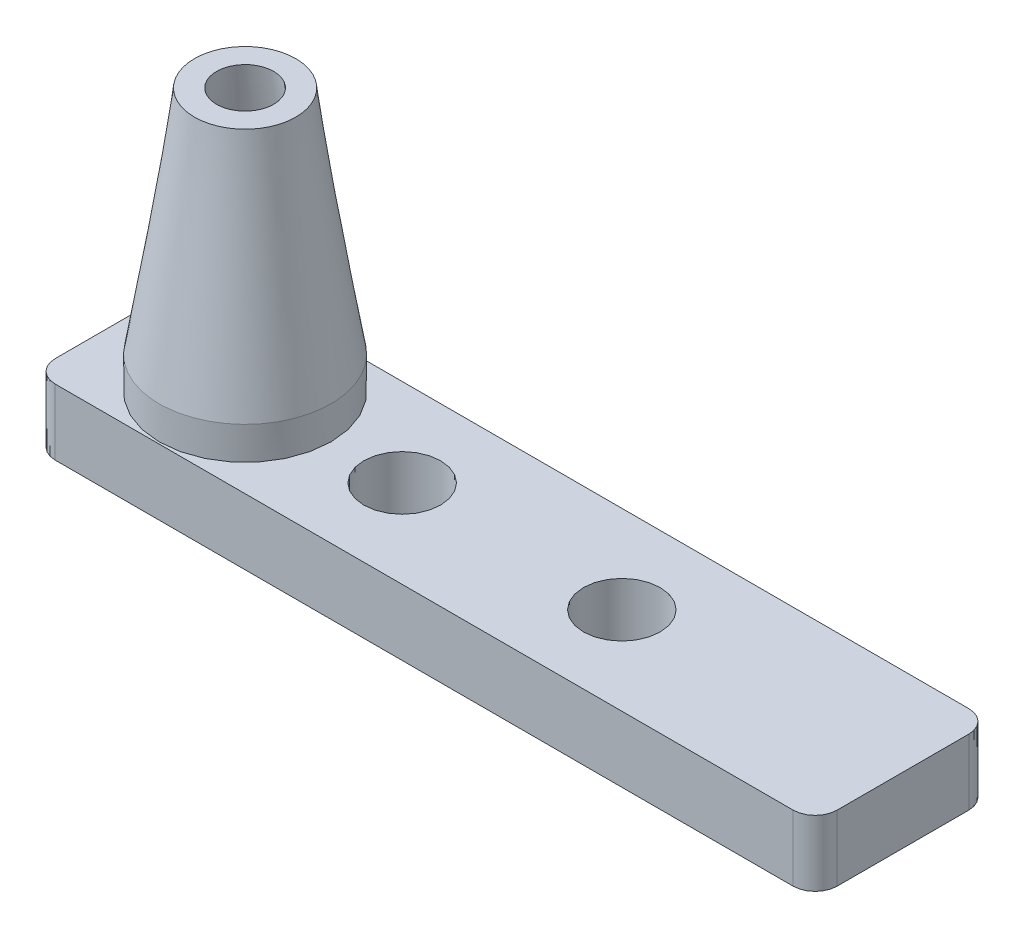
SolidWorks part; units mm, degrees
ref_plane "前视基准面" through (0, 0, 0) normal (0, 0, 1) x (1, 0, 0)
ref_plane "上视基准面" through (0, 0, 0) normal (0, 1, 0) x (1, 0, 0)
ref_plane "右视基准面" through (0, 0, 0) normal (1, 0, 0) x (0, 0, -1)
sketch "草图1" plane through (0, 0, 0) normal (0, 1, 0) x (1, 0, 0)
  line L0 (-34.4545, 0) -> (25.7273, 0) construction
  line L1 (-17.8, 4) -> (17.8, 4)
  line L2 (-17.8, 4) -> (-17.8, -4)
  line L3 (-17.8, -4) -> (17.8, -4)
  line L4 (17.8, 4) -> (17.8, -4)
  line L5 (-17.8, 4) -> (17.8, -4) construction
  line L6 (-17.8, -4) -> (17.8, 4) construction
  line L7 (0, 25.0909) -> (0, -26) construction
  point P0 (0, 0)
  dimension "D1" = 8
  dimension "D2" = 35.6
extrude "凸台-拉伸1" add sketch "草图1" against normal blind 4.5
sketch "草图2" plane through (0, 0, 0) normal (0, 1, 0) x (1, 0, 0)
  line L0 (0, 11.2893) -> (0, -8.6952) construction
  line L1 (-18.3992, 0) -> (19.424, 0) construction
  circle A0 centre (-12.15, 0) radius 2.9
  dimension "D2" = 5.8
  dimension "D1" = 12.15
ref_plane "基准面4" through (0, 10.5, 0) normal (0, 1, 0) x (1, 0, 0)
sketch "草图3" plane through (0, 10.5, 0) normal (0, 1, 0) x (1, 0, 0)
  line L0 (-23.5027, 0) -> (25.4855, 0) construction
  line L1 (0, 14.6872) -> (0, -13.9655) construction
  circle A0 centre (-12.15, 0) radius 1.3
  dimension "D2" = 2.6
  dimension "D1" = 12.15
loft "放样-薄件3" add profiles "草图2", "草图3" parameters "D1"=1
sketch "草图5" plane through (0, 0, 0) normal (0, 1, 0) x (1, 0, 0)
  line L0 (-23.6691, 0) -> (21.9887, 0) construction
  circle A0 centre (-12.15, 0) radius 3
  dimension "D2" = 6
  dimension "D1" = 12.15
extrude "切除-拉伸1" cut sketch "草图5" against normal up to next
sketch "草图6" plane through (0, 0, 0) normal (0, 1, 0) x (1, 0, 0)
  line L3 (-17.8, 4) -> (-17.8, -4)
  line L4 (17.8, -4) -> (17.8, 4)
  line L5 (17.8, 4) -> (-17.8, 4)
  line L8 (17.8, -4) -> (17.8, 4)
  line L9 (17.8, 4) -> (-17.8, 4)
  line L12 (-17.8, 4) -> (-17.8, -4)
  line L13 (-17.8, -4) -> (17.8, -4)
  line L14 (-17.8, -4) -> (17.8, -4)
  circle A0 centre (-12.15, 0) radius 3.914 construction
  circle A1 centre (-12.15, 0) radius 3.914
  dimension "D1" = 0
extrude "切除-拉伸2" cut sketch "草图6" against normal blind 1.5
fillet "圆角1" radius 1 4 edges at (-17.8, -3, 4) (17.8, -3, -4) (17.8, -3, 4) (-17.8, -3, -4)
sketch "草图7" plane through (0, 0, 0) normal (0, 1, 0) x (1, 0, 0)
  line L0 (-23.1363, 0) -> (23.5052, 0) construction
  line L1 (0, 10.3079) -> (0, -10.8407) construction
  circle A0 centre (-5, 0) radius 1.75
  circle A1 centre (5, 0) radius 1.75
  dimension "D1" = 3.5
  dimension "D2" = 5
extrude "切除-拉伸3" cut sketch "草图7" against normal through all and the other way through all
